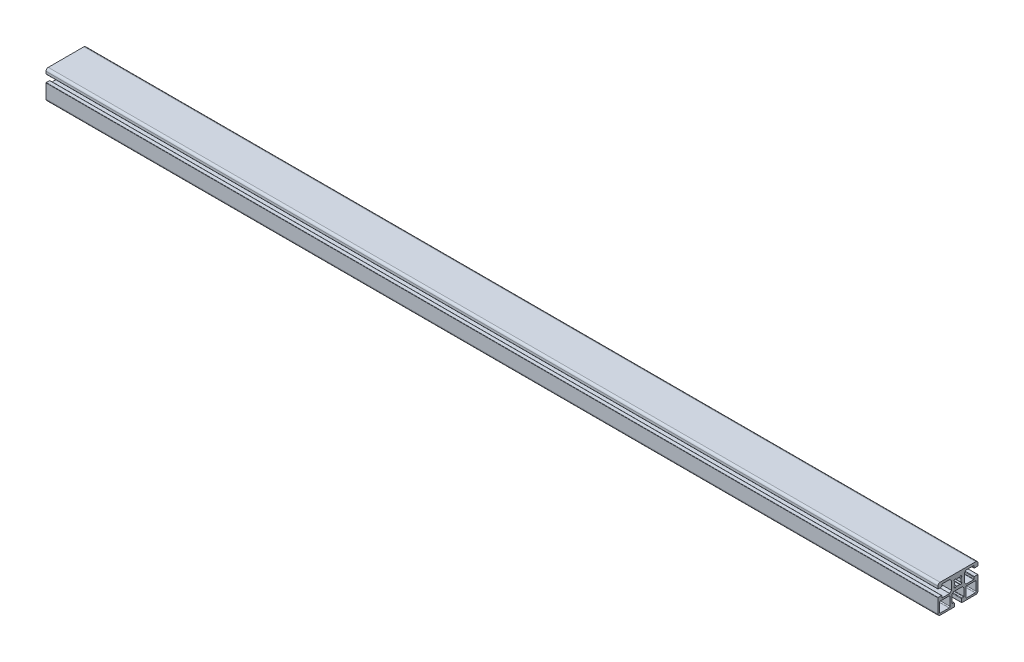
SolidWorks part; units mm, degrees
ref_plane "Front Plane" through (0, 0, 0) normal (0, 0, 1) x (1, 0, 0)
ref_plane "Top Plane" through (0, 0, 0) normal (0, 1, 0) x (1, 0, 0)
ref_plane "Right Plane" through (0, 0, 0) normal (1, 0, 0) x (0, 0, -1)
sketch "Sketch1" plane through (0, 0, 0) normal (0, 0, 1) x (1, 0, 0)
  line L0 (0, 0) -> (1000, 0)
  dimension "D1" = 1000
other "45-sarja 1.0072 ALUMIINIPROFIILI 45X32 L(1)"
ref_plane "Plane1" through (0, 0, 0) normal (1, 0, 0) x (0, 0, -1)
sketch "Sketch12" plane through (0, 0, 0) normal (1, 0, 0) x (0, 0, -1)
  line L0 (-9.5361, -2.4979) -> (-19.2361, -2.4979)
  line L1 (-20.2361, -3.4979) -> (-20.2361, -13.1979)
  line L2 (-19.2361, -14.1979) -> (-9.5361, -14.1979)
  line L3 (-8.5361, -13.1979) -> (-8.5361, -3.4979)
  line L4 (19.7274, -2.4979) -> (10.0274, -2.4979)
  line L5 (9.0639, -3.4979) -> (9.0639, -13.1979)
  line L6 (10.0274, -14.1979) -> (19.7274, -14.1979)
  line L7 (20.7639, -13.1979) -> (20.7639, -3.4979)
  line L8 (-4.1202, 2.908) -> (-3.1302, 1.918)
  line L9 (-2.706, 1.918) -> (-1.6852, 2.9388)
  line L10 (2.213, 2.9388) -> (3.2337, 1.918)
  line L11 (3.658, 1.918) -> (4.6479, 2.908)
  line L12 (4.6479, 3.3322) -> (3.4716, 4.5086)
  line L13 (3.6272, 8.2512) -> (4.6479, 9.2719)
  line L14 (4.6479, 9.6962) -> (3.658, 10.6861)
  line L15 (3.2337, 10.6861) -> (2.213, 9.6654)
  line L16 (-1.6852, 9.6654) -> (-2.706, 10.6861)
  line L17 (-3.1302, 10.6861) -> (-4.1202, 9.6962)
  line L18 (-4.1202, 9.2719) -> (-3.0994, 8.2512)
  line L19 (-3.0994, 4.353) -> (-4.1202, 3.3322)
  line L20 (18.7639, 10.4021) -> (22.4639, 10.4021)
  line L21 (18.2639, 12.8021) -> (18.2639, 10.9021)
  line L22 (9.4639, 13.1021) -> (17.9639, 13.1021)
  line L23 (7.4639, 11.1021) -> (9.4639, 13.1021)
  line L24 (7.4639, 1.5021) -> (7.4639, 11.1021)
  line L25 (9.4639, -0.4979) -> (7.4639, 1.5021)
  line L26 (17.9639, -0.4979) -> (9.4639, -0.4979)
  line L27 (18.2639, 1.7021) -> (18.2639, -0.1979)
  line L28 (22.4639, 2.2021) -> (18.7639, 2.2021)
  line L29 (22.7639, -13.6979) -> (22.7639, 1.9021)
  line L30 (4.6639, -16.1979) -> (20.2639, -16.1979)
  line L31 (4.3639, -12.1979) -> (4.3639, -15.8979)
  line L32 (6.7639, -11.6979) -> (4.8639, -11.6979)
  line L33 (7.0639, -2.8979) -> (7.0639, -11.3979)
  line L34 (5.0639, -0.8979) -> (7.0639, -2.8979)
  line L35 (-4.5361, -0.8979) -> (5.0639, -0.8979)
  line L36 (-6.5361, -2.8979) -> (-4.5361, -0.8979)
  line L37 (-6.5361, -11.3979) -> (-6.5361, -2.8979)
  line L38 (-4.3361, -11.6979) -> (-6.2361, -11.6979)
  line L39 (-3.8361, -15.8979) -> (-3.8361, -12.1979)
  line L40 (-19.7361, -16.1979) -> (-4.1361, -16.1979)
  line L41 (-22.2361, 1.9021) -> (-22.2361, -13.6979)
  line L42 (-18.2361, 2.2021) -> (-21.9361, 2.2021)
  line L43 (-17.7361, -0.1979) -> (-17.7361, 1.7021)
  line L44 (-8.9361, -0.4979) -> (-17.4361, -0.4979)
  line L45 (-6.9361, 1.5021) -> (-8.9361, -0.4979)
  line L46 (-6.9361, 11.1021) -> (-6.9361, 1.5021)
  line L47 (-8.9361, 13.1021) -> (-6.9361, 11.1021)
  line L48 (-17.4361, 13.1021) -> (-8.9361, 13.1021)
  line L49 (-17.7361, 10.9021) -> (-17.7361, 12.8021)
  line L50 (-21.9361, 10.4021) -> (-18.2361, 10.4021)
  line L51 (-22.2361, 13.3021) -> (-22.2361, 10.7021)
  line L52 (20.2639, 15.8021) -> (-19.7361, 15.8021)
  line L53 (22.7639, 10.7021) -> (22.7639, 13.3021)
  arc A0 (-8.5361, -3.4979) -> (-9.5361, -2.4979) centre (-9.5361, -3.4979) ccw
  arc A1 (-19.2361, -2.4979) -> (-20.2361, -3.4979) centre (-19.2361, -3.4979) ccw
  arc A2 (-20.2361, -13.1979) -> (-19.2361, -14.1979) centre (-19.2361, -13.1979) ccw
  arc A3 (-9.5361, -14.1979) -> (-8.5361, -13.1979) centre (-9.5361, -13.1979) ccw
  arc A4 (20.7639, -3.4979) -> (19.7274, -2.4979) centre (19.7639, -3.4972) ccw
  arc A5 (10.0274, -2.4979) -> (9.0639, -3.4979) centre (10.0639, -3.4972) ccw
  arc A6 (9.0639, -13.1979) -> (10.0274, -14.1979) centre (10.0639, -13.1986) ccw
  arc A7 (19.7274, -14.1979) -> (20.7639, -13.1979) centre (19.7639, -13.1986) ccw
  arc A8 (-4.1202, 3.3322) -> (-4.1202, 2.908) centre (-3.908, 3.1201) ccw
  arc A9 (-3.1302, 1.918) -> (-2.706, 1.918) centre (-2.9181, 2.1302) ccw
  arc A10 (-1.342, 2.9965) -> (-1.6852, 2.9388) centre (-1.4731, 2.7267) ccw
  arc A11 (-1.342, 2.9965) -> (1.8697, 2.9965) centre (0.2639, 6.3021) ccw
  arc A12 (2.213, 2.9388) -> (1.8697, 2.9965) centre (2.0008, 2.7267) ccw
  arc A13 (3.2337, 1.918) -> (3.658, 1.918) centre (3.4459, 2.1302) ccw
  arc A14 (4.6479, 2.908) -> (4.6479, 3.3322) centre (4.4358, 3.1201) ccw
  arc A15 (3.4716, 4.5086) -> (3.5695, 7.9079) centre (0.2639, 6.3021) ccw
  arc A16 (3.6272, 8.2512) -> (3.5695, 7.9079) centre (3.8393, 8.039) ccw
  arc A17 (4.6479, 9.2719) -> (4.6479, 9.6962) centre (4.4358, 9.4841) ccw
  arc A18 (3.658, 10.6861) -> (3.2337, 10.6861) centre (3.4459, 10.474) ccw
  arc A19 (1.8697, 9.6077) -> (2.213, 9.6654) centre (2.0008, 9.8775) ccw
  arc A20 (1.8697, 9.6077) -> (-1.342, 9.6077) centre (0.2639, 6.3021) ccw
  arc A21 (-1.6852, 9.6654) -> (-1.342, 9.6077) centre (-1.4731, 9.8775) ccw
  arc A22 (-2.706, 10.6861) -> (-3.1302, 10.6861) centre (-2.9181, 10.474) ccw
  arc A23 (-4.1202, 9.6962) -> (-4.1202, 9.2719) centre (-3.908, 9.4841) ccw
  arc A24 (-3.0417, 7.9079) -> (-3.0994, 8.2512) centre (-3.3115, 8.039) ccw
  arc A25 (-3.0417, 7.9079) -> (-3.0417, 4.6962) centre (0.2639, 6.3021) ccw
  arc A26 (-3.0994, 4.353) -> (-3.0417, 4.6962) centre (-3.3115, 4.5651) ccw
  arc A27 (18.2639, 10.9021) -> (18.7639, 10.4021) centre (18.7639, 10.9021) ccw
  arc A28 (18.2639, 12.8021) -> (17.9639, 13.1021) centre (17.9639, 12.8021) ccw
  arc A29 (17.9639, -0.4979) -> (18.2639, -0.1979) centre (17.9639, -0.1979) ccw
  arc A30 (18.7639, 2.2021) -> (18.2639, 1.7021) centre (18.7639, 1.7021) ccw
  arc A31 (22.7639, 1.9021) -> (22.4639, 2.2021) centre (22.4639, 1.9021) ccw
  arc A32 (20.2639, -16.1979) -> (22.7639, -13.6979) centre (20.2639, -13.6979) ccw
  arc A33 (4.3639, -15.8979) -> (4.6639, -16.1979) centre (4.6639, -15.8979) ccw
  arc A34 (4.8639, -11.6979) -> (4.3639, -12.1979) centre (4.8639, -12.1979) ccw
  arc A35 (6.7639, -11.6979) -> (7.0639, -11.3979) centre (6.7639, -11.3979) ccw
  arc A36 (-6.5361, -11.3979) -> (-6.2361, -11.6979) centre (-6.2361, -11.3979) ccw
  arc A37 (-3.8361, -12.1979) -> (-4.3361, -11.6979) centre (-4.3361, -12.1979) ccw
  arc A38 (-4.1361, -16.1979) -> (-3.8361, -15.8979) centre (-4.1361, -15.8979) ccw
  arc A39 (-22.2361, -13.6979) -> (-19.7361, -16.1979) centre (-19.7361, -13.6979) ccw
  arc A40 (-21.9361, 2.2021) -> (-22.2361, 1.9021) centre (-21.9361, 1.9021) ccw
  arc A41 (-17.7361, 1.7021) -> (-18.2361, 2.2021) centre (-18.2361, 1.7021) ccw
  arc A42 (-17.7361, -0.1979) -> (-17.4361, -0.4979) centre (-17.4361, -0.1979) ccw
  arc A43 (-17.4361, 13.1021) -> (-17.7361, 12.8021) centre (-17.4361, 12.8021) ccw
  arc A44 (-18.2361, 10.4021) -> (-17.7361, 10.9021) centre (-18.2361, 10.9021) ccw
  arc A45 (-22.2361, 10.7021) -> (-21.9361, 10.4021) centre (-21.9361, 10.7021) ccw
  arc A46 (-19.7361, 15.8021) -> (-22.2361, 13.3021) centre (-19.7361, 13.3021) ccw
  arc A47 (22.7639, 13.3021) -> (20.2639, 15.8021) centre (20.2639, 13.3021) ccw
  arc A48 (22.4639, 10.4021) -> (22.7639, 10.7021) centre (22.4639, 10.7021) ccw
  point P149 (22.7639, 13.3021)
  point P150 (-19.7361, 15.8021)
  point P151 (-22.2361, -13.6979)
  point P152 (20.2639, -16.1979)
  point P153 (0.2639, 15.8021)
  point P154 (-22.2361, 15.8021)
  point P155 (22.7639, 15.8021)
  point P156 (22.7639, 6.3021)
  point P157 (-22.2361, 6.3021)
  point P158 (0.2639, -16.1979)
  point P159 (-22.2361, -16.1979)
  point P160 (22.7639, -16.1979)
  point P161 (0.2639, 6.3021)
  point P162 (0, 0)
